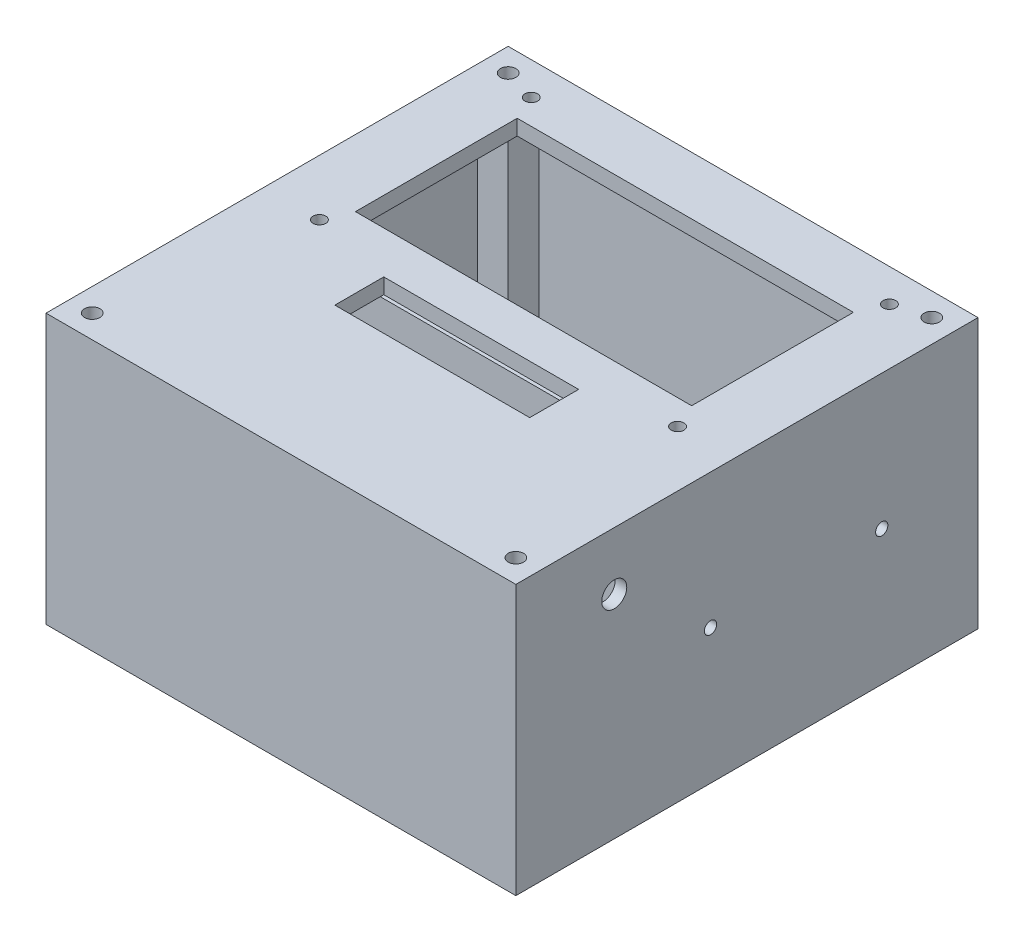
SolidWorks part; units mm, degrees
ref_plane "Front Plane" through (0, 0, 0) normal (0, 0, 1) x (1, 0, 0)
ref_plane "Top Plane" through (0, 0, 0) normal (0, 1, 0) x (1, 0, 0)
ref_plane "Right Plane" through (0, 0, 0) normal (1, 0, 0) x (0, 0, -1)
sketch "Sketch1" plane through (0, 0, 0) normal (0, 1, 0) x (1, 0, 0)
  line L1 (61, -60) -> (-61, -60)
  line L2 (61, -60) -> (61, 60)
  line L3 (61, 60) -> (-61, 60)
  line L4 (-61, -60) -> (-61, 60)
  line L5 (61, -60) -> (-61, 60) construction
  line L6 (61, 60) -> (-61, -60) construction
  point P0 (0, 0)
  dimension "D1" = 120
  dimension "D2" = 122
extrude "Boss-Extrude_MAIN_CASE" add sketch "Sketch1" along normal blind 60 and the other way blind 10
sketch "Sketch_MAIN_HOLE" plane through (0, -10, 0) normal (0, -1, 0) x (1, 0, 0)
  line L0 (-61, 60) -> (61, 60) construction
  line L1 (-58, 57) -> (58, 57)
  line L2 (-58, 57) -> (-58, -57)
  line L3 (-58, -57) -> (58, -57)
  line L4 (58, 57) -> (58, -57)
  line L5 (-58, 57) -> (58, -57) construction
  line L6 (-58, -57) -> (58, 57) construction
  line L7 (-61, -60) -> (-61, 60) construction
  line L8 (61, -60) -> (-61, -60) construction
  line L9 (61, 60) -> (61, -60) construction
  point P0 (0, 0)
  dimension "D1" = 3
  dimension "D2" = 3
  dimension "D3" = 3
  dimension "D4" = 3
extrude "Cut-Extrude_MAIN" cut sketch "Sketch_MAIN_HOLE" against normal blind 66 contours L1 L4 L3 L2
sketch "Sketch_LCD_BEZEL" plane through (0, 60, 0) normal (0, 1, 0) x (1, 0, 0)
  line L0 (-61, 24) -> (61, 24) construction
  line L1 (-61, 60) -> (-61, -60) construction
  line L2 (61, -60) -> (61, 60) construction
  line L3 (61, 60) -> (-61, 60) construction
  line L4 (43.65, 45) -> (-43.65, 45)
  line L5 (43.65, 45) -> (43.65, 3)
  line L6 (43.65, 3) -> (-43.65, 3)
  line L7 (-43.65, 45) -> (-43.65, 3)
  line L8 (43.65, 45) -> (-43.65, 3) construction
  line L9 (43.65, 3) -> (-43.65, 45) construction
  point P6 (0, 24)
  dimension "D1" = 87.3
  dimension "D2" = 42
  dimension "D3" = 15
extrude "Cut-Extrude_LCD" cut sketch "Sketch_LCD_BEZEL" against normal blind 47.15
sketch "Sketch_LCD_PCB" plane through (0, 56, 0) normal (0, -1, 0) x (1, 0, 0)
  line L0 (0, -3) -> (0, -45) construction
  line L1 (43.65, -3) -> (-43.65, -3) construction
  line L2 (-43.65, -45) -> (43.65, -45) construction
  line L3 (43.65, -24) -> (0, -24) construction
  line L4 (43.65, -45) -> (43.65, -3) construction
  line L5 (0, -24) -> (-43.65, -24) construction
  line L6 (-43.65, -3) -> (-43.65, -45) construction
  line L7 (43.65, -45) -> (-43.65, -45) construction
  line L8 (49, 6) -> (-49, 6)
  line L9 (49, 6) -> (49, -54)
  line L10 (49, -54) -> (-49, -54)
  line L11 (-49, 6) -> (-49, -54)
  line L12 (49, 6) -> (-49, -54) construction
  line L13 (49, -54) -> (-49, 6) construction
  line L14 (61, -60) -> (-61, -60) construction
  dimension "D1" = 98
  dimension "D2" = 60
sketch "Sketch26" plane through (0, 60, 0) normal (0, 1, 0) x (1, 0, 0)
  line L0 (49, 54) -> (-49, 54) construction
  line L1 (-49, -6) -> (-49, 54) construction
  line L2 (49, -6) -> (49, 54) construction
  line L3 (49, -6) -> (-49, -6) construction
  circle A0 centre (-46.5, 51.5) radius 1.65
  circle A1 centre (46.5, 51.5) radius 1.65
  circle A2 centre (46.5, -3.5) radius 1.65
  circle A3 centre (-46.5, -3.5) radius 1.65
  dimension "D1" = 2.5
  dimension "D3" = 3.3
  dimension "D4" = 2.5
  dimension "D6" = 3.3
  dimension "D7" = 2.5
  dimension "D8" = 2.5
  dimension "D9" = 3.3
  dimension "D10" = 2.5
  dimension "D11" = 2.5
  dimension "D12" = 3.3
  dimension "D2" = 2.5
  dimension "D5" = 2.5
extrude "Cut-Extrude_LCD_SCREWS" cut sketch "Sketch26" against normal through all
sketch "Sketch34" plane through (-58, 0, 0) normal (1, 0, 0) x (0, 0, -1)
  line L0 (-57, 23) -> (57, 23) construction
  line L1 (-57, 56) -> (-57, -10) construction
  line L2 (57, 56) -> (57, -10) construction
  line L3 (-57, 56) -> (57, 56) construction
  line L4 (-44, 44) -> (-34.475, 44)
  line L5 (-44, 44) -> (-44, 2)
  line L6 (-44, 2) -> (-34.475, 2)
  line L7 (-34.475, 44) -> (-34.475, 2)
  line L8 (-44, 44) -> (-34.475, 2) construction
  line L9 (-44, 2) -> (-34.475, 44) construction
  point P6 (-39.2375, 23)
  dimension "D1" = 9.525
  dimension "D2" = 42
  dimension "D3" = 12
  dimension "D4" = 13
extrude "Boss-Extrude_SOLENOID_BASE" add sketch "Sketch34" along normal blind 54
sketch "Sketch38" plane through (0, 0, 34.475) normal (0, 0, -1) x (-1, 0, 0)
  line L0 (4, 2) -> (58, 2) construction
  line L1 (58, 2) -> (58, 44) construction
  line L2 (4, 2) -> (4, 44) construction
  line L3 (4, 44) -> (58, 44) construction
  circle A0 centre (48, 7) radius 1.5
  circle A1 centre (14, 7) radius 1.5
  circle A2 centre (48, 39) radius 1.5
  circle A3 centre (14, 39) radius 1.5
  dimension "D1" = 5
  dimension "D2" = 10
  dimension "D3" = 3
  dimension "D4" = 10
  dimension "D5" = 5
  dimension "D6" = 3
  dimension "D7" = 5
  dimension "D8" = 10
  dimension "D9" = 3
  dimension "D10" = 10
  dimension "D11" = 5
  dimension "D12" = 3
extrude "Cut-Extrude_SOLENOID_SCREWS" cut sketch "Sketch38" against normal up to next
sketch "Sketch41" plane through (-58, 0, 0) normal (1, 0, 0) x (0, 0, -1)
  line L1 (-34.475, 23) -> (12.8711, 23) construction
  line L2 (-34.475, 2) -> (-34.475, 44) construction
  line L3 (-34.475, 2) -> (12.8711, 2) construction
  line L4 (-34.475, 44) -> (12.8711, 44) construction
  circle A0 centre (-21.225, 23) radius 8.5
  dimension "D2" = 17
  dimension "D1" = 13.25
  dimension "D3" = 21
extrude "Cut-Extrude_SOLENOID_HOLE" cut sketch "Sketch41" against normal through all
sketch "Sketch53" plane through (61, 0, 0) normal (1, 0, 0) x (0, 0, -1)
  line L0 (-60, -10) -> (-60, 60) construction
  line L1 (-60, 25) -> (60, 25) construction
  line L2 (60, -10) -> (60, 60) construction
  line L3 (-9.45, -10) -> (-9.45, 60) construction
  line L4 (-60, -10) -> (60, -10) construction
  line L5 (-60, 60) -> (60, 60) construction
  circle A0 centre (-9.45, 25) radius 1.5875
  circle A1 centre (35, 25) radius 1.5875
  circle A2 centre (-34.45, 45) radius 3.25
  dimension "D1" = 3.175
  dimension "D2" = 3.175
  dimension "D3" = 44.45
  dimension "D4" = 25
  dimension "D5" = 6.5
  dimension "D6" = 20
  dimension "D7" = 25
extrude "Cut-Extrude_BATTERY_HOLDER" cut sketch "Sketch53" against normal up to next
sketch "Sketch58" plane through (0, 0, -60) normal (0, 0, -1) x (-1, 0, 0)
  line L0 (61, 25) -> (-61, 25) construction
  line L1 (61, -10) -> (61, 60) construction
  line L2 (-61, -10) -> (-61, 60) construction
  line L4 (-24, 19) -> (-38, 19)
  line L5 (-24, 19) -> (-24, 31)
  line L6 (-24, 31) -> (-38, 31)
  line L7 (-38, 19) -> (-38, 31)
  line L8 (-24, 19) -> (-38, 31) construction
  line L9 (-24, 31) -> (-38, 19) construction
  point P6 (-31, 25)
  dimension "D1" = 14
  dimension "D2" = 12
  dimension "D3" = 85
extrude "Cut-Extrude_POWER_SWITCH" cut sketch "Sketch58" against normal up to next
sketch "Sketch59" plane through (0, 60, 0) normal (0, 1, 0) x (1, 0, 0)
  line L0 (0, -60) -> (0, 3) construction
  line L1 (-61, -60) -> (61, -60) construction
  line L2 (-43.65, 3) -> (43.65, 3) construction
  line L9 (43.65, 3) -> (-43.65, 3) construction
  line L10 (25.3, -8) -> (-25.3, -8)
  line L11 (25.3, -8) -> (25.3, -20.7)
  line L15 (25.3, -20.7) -> (-25.3, -20.7)
  line L16 (-25.3, -8) -> (-25.3, -20.7)
  line L17 (25.3, -8) -> (-25.3, -20.7) construction
  line L18 (25.3, -20.7) -> (-25.3, -8) construction
  point P12 (0, -14.35)
  dimension "D1" = 11
  dimension "D2" = 12.7
  dimension "D3" = 50.6
sketch "Sketch60" plane through (0, 56, 0) normal (0, -1, 0) x (1, 0, 0)
  line L0 (0, 57) -> (0, -57) construction
  line L1 (-58, 57) -> (58, 57) construction
  line L2 (-58, -57) -> (58, -57) construction
  line L3 (58, 0) -> (-58, 0) construction
  line L4 (58, 57) -> (58, -57) construction
  line L5 (-58, 57) -> (-58, -57) construction
  line L7 (-58, -57) -> (-50, -57)
  line L8 (-58, -57) -> (-58, -49)
  line L9 (-58, -49) -> (-50, -49)
  line L10 (-50, -57) -> (-50, -49)
  line L11 (-58, 57) -> (-50, 57)
  line L12 (-58, 57) -> (-58, 49)
  line L13 (-58, 49) -> (-50, 49)
  line L14 (-50, 57) -> (-50, 49)
  line L15 (58, 57) -> (50, 57)
  line L16 (58, 57) -> (58, 49)
  line L17 (58, 49) -> (50, 49)
  line L18 (50, 57) -> (50, 49)
  line L19 (58, -57) -> (50, -57)
  line L20 (58, -57) -> (58, -49)
  line L21 (58, -49) -> (50, -49)
  line L22 (50, -57) -> (50, -49)
  point P32 (-54, -49)
  point P33 (54, 49)
  point P34 (-54, -57)
  dimension "D1" = 100
  dimension "D2" = 100
  dimension "D3" = 8
  dimension "D4" = 8
  dimension "D5" = 98
  dimension "D6" = 98
  dimension "D7" = 8
  dimension "D8" = 8
extrude "Boss-Extrude_CORNER_STANDOFFS" add sketch "Sketch60" along direction (0, 1, 0) on the side of the normal up to surface (66 mm away)
sketch "Sketch62" plane through (0, -10, 0) normal (0, -1, 0) x (-1, 0, 0)
  line L0 (61, 60) -> (61, -60) construction
  line L1 (61, -60) -> (-61, -60) construction
  line L2 (-61, -60) -> (-61, 60) construction
  line L3 (-61, 60) -> (61, 60) construction
  circle A0 centre (55, -54) radius 2
  circle A1 centre (-55, -54) radius 2
  circle A2 centre (55, 54) radius 2
  circle A3 centre (-55, 54) radius 2
  dimension "D1" = 4
  dimension "D3" = 6
  dimension "D4" = 6
  dimension "D6" = 4
  dimension "D7" = 4
  dimension "D8" = 6
  dimension "D9" = 6
  dimension "D10" = 4
  dimension "D11" = 6
  dimension "D12" = 6
  dimension "D2" = 6
  dimension "D5" = 6
extrude "Cut-Extrude_CORNER_HOLES" cut sketch "Sketch62" against normal through all
sketch "Sketch65" plane through (-58, 0, 0) normal (1, 0, 0) x (0, 0, -1)
  line L0 (-34.475, 23) -> (49, 23) construction
  line L1 (-34.475, 2) -> (-34.475, 44) construction
  line L2 (49, -10) -> (49, 56) construction
  line L4 (1.875, 51.575) -> (-4.475, 51.575)
  line L5 (1.875, 51.575) -> (1.875, -5.575)
  line L6 (1.875, -5.575) -> (-4.475, -5.575)
  line L7 (-4.475, 51.575) -> (-4.475, -5.575)
  line L8 (1.875, 51.575) -> (-4.475, -5.575) construction
  line L9 (1.875, -5.575) -> (-4.475, 51.575) construction
  point P6 (-1.3, 23)
  point P11 (-1.3, 51.575)
  dimension "D1" = 57.15
  dimension "D2" = 30
  dimension "D3" = 6.35
extrude "Cut-Extrude_KEYPAD" cut sketch "Sketch59" against normal up to next
extrude "Boss-Extrude_PCB_BASE" add sketch "Sketch65" along normal blind 91.5
sketch "Sketch67" plane through (-58, 0, 0) normal (1, 0, 0) x (0, 0, -1)
  line L0 (1.875, 51.575) -> (49, 51.575) construction
  line L1 (49, -10) -> (49, 56) construction
  line L2 (1.875, -5.575) -> (1.875, 51.575) construction
  circle A0 centre (8.375, 46.575) radius 2.75
  dimension "D2" = 5.5
  dimension "D1" = 5
  dimension "D3" = 6.5
extrude "Cut-Extrude_PCB_ACDC_BARREL_JACK" cut sketch "Sketch67" against normal up to next
sketch "Sketch71" plane through (-61, 0, 0) normal (-1, 0, 0) x (0, 0, 1)
  line L3 (4.4864, 45.499) -> (4.4864, 0.4902) construction
  line L4 (4.4864, 45.499) -> (-1.8636, 45.499) construction
  line L5 (-1.8636, 45.499) -> (-1.8636, 0.4902) construction
  line L6 (-1.8636, 0.4902) -> (4.4864, 0.4902) construction
  line L8 (4.4864, 45.499) -> (-1.8636, 0.4902) construction
  line L9 (4.4864, 0.4902) -> (-1.8636, 45.499) construction
  line L13 (-60, -10) -> (60, -10) construction
  circle A0 centre (1.3114, 39.149) radius 2.413
  circle A1 centre (1.3114, 6.8402) radius 2.413
  circle A2 centre (21.225, 23) radius 8.5 construction
  point P6 (1.3114, 22.9946)
  dimension "D1" = 45.0088
  dimension "D3" = 16.7386
  dimension "D5" = 4.826
  dimension "D6" = 6.35
  dimension "D7" = 3.175
  dimension "D8" = 6.35
  dimension "D9" = 4.826
  dimension "D10" = 3.175
  dimension "D2" = 6.35
  dimension "D4" = 10.4902
extrude "Cut-Extrude_PCB_BASE_SCREWS" cut sketch "Sketch71" against normal blind 38.1
sketch "Sketch74" plane through (-61, 0, 0) normal (-1, 0, 0) x (0, 0, 1)
  line L1 (34.4838, 44.0004) -> (44.0088, 44.0004) construction
  line L2 (34.4838, 1.9888) -> (34.4838, 44.0004) construction
  line L3 (34.4838, 1.9888) -> (44.0088, 1.9888) construction
  line L4 (44.0088, 44.0004) -> (44.0088, 1.9888) construction
  line L5 (34.4838, 44.0004) -> (44.0088, 1.9888) construction
  line L6 (34.4838, 1.9888) -> (44.0088, 44.0004) construction
  circle A0 centre (39.2336, 13.4188) radius 2.413
  circle A3 centre (21.225, 23) radius 8.5 construction
  circle A4 centre (39.2463, 32.5704) radius 2.413
  point P0 (39.2463, 22.9946)
  dimension "D1" = 13.2588
  dimension "D4" = 4.826
  dimension "D5" = 4.826
  dimension "D6" = 4.7752
  dimension "D7" = 11.43
  dimension "D2" = 11.43
  dimension "D3" = 42.0116
extrude "Cut-Extrude_SOLENOID_BASE_SCREWS" cut sketch "Sketch74" against normal blind 38.1
